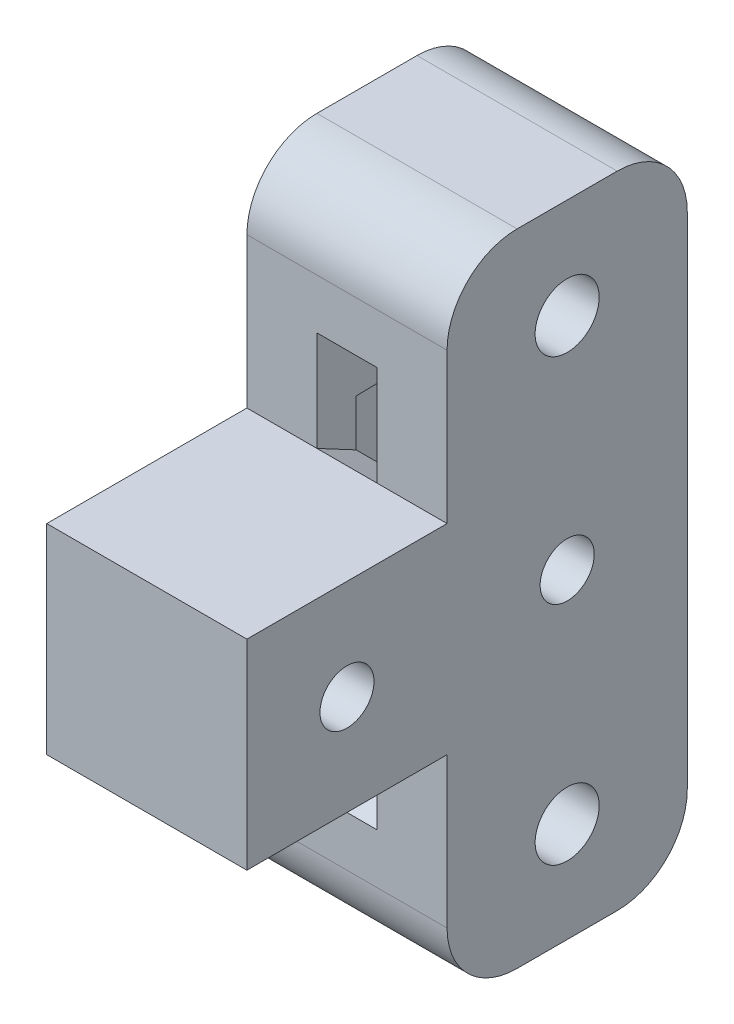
SolidWorks part; units mm, degrees
ref_plane "正面" through (0, 0, 0) normal (1, 0, 0) x (0, 1, 0)
ref_plane "平面" through (0, 0, 0) normal (0, 0, 1) x (0, 1, 0)
ref_plane "右側面" through (0, 0, 0) normal (0, 1, 0) x (-1, 0, 0)
sketch "ｽｹｯﾁ1" plane through (0, 0, 0) normal (1, 0, 0) x (0, 1, 0)
  line L0 (-24.7464, 0) -> (-24.7464, -24)
  line L1 (-24.7464, -24) -> (39.2536, -24)
  line L2 (39.2536, -24) -> (39.2536, 0)
  line L3 (39.2536, 0) -> (17.2536, 0)
  line L4 (17.2536, 0) -> (17.2536, 20)
  line L5 (17.2536, 20) -> (-2.7464, 20)
  line L6 (-2.7464, 20) -> (-2.7464, 0)
  line L7 (-2.7464, 0) -> (-24.7464, 0)
  circle A0 centre (7.2536, -12) radius 2.7
  circle A1 centre (29.2536, -12) radius 3.2
  circle A2 centre (-14.7464, -12) radius 3.2
  circle A3 centre (7.2536, 10) radius 2.7
  dimension "D7" = 5.4
  dimension "D8" = 5.4
  dimension "D9" = 6.4
  dimension "D10" = 6.4
  dimension "D1" = 64
  dimension "D2" = 22
  dimension "D3" = 22
  dimension "D4" = 24
  dimension "D5" = 24
  dimension "D6" = 44
  dimension "D11" = 10
  dimension "D12" = 32
  dimension "D13" = 54
  dimension "D14" = 32
  dimension "D15" = 12
  dimension "D16" = 12
  dimension "D17" = 12
  dimension "D18" = 34
extrude "ﾎﾞｽ - 押し出し1" add sketch "ｽｹｯﾁ1" along normal mid plane 20
sketch "ｽｹｯﾁ2" plane through (0, 0, 0) normal (0, 0, 1) x (1, 0, 0)
  line L0 (10, -2.7464) -> (-10, -2.7464) construction
  line L1 (-3, -12.7464) -> (3, -12.7464)
  line L2 (-3, -12.7464) -> (-3, -2.7464)
  line L3 (-3, -2.7464) -> (3, -2.7464)
  line L4 (3, -12.7464) -> (3, -2.7464)
  line L5 (-3, -12.7464) -> (3, -2.7464) construction
  line L6 (-3, -2.7464) -> (3, -12.7464) construction
  line L8 (10, -2.7464) -> (10, -24.7464) construction
  point P0 (0, -7.7464)
  dimension "D1" = 6
  dimension "D2" = 10
  dimension "D3" = 7
sketch "ｽｹｯﾁ3" plane through (0, 0, 0) normal (0, 0, 1) x (1, 0, 0)
  line L0 (10, 17.2536) -> (-10, 17.2536) construction
  line L1 (-3, 27.2536) -> (3, 27.2536)
  line L2 (-3, 27.2536) -> (-3, 17.2536)
  line L3 (-3, 17.2536) -> (3, 17.2536)
  line L4 (3, 27.2536) -> (3, 17.2536)
  line L5 (-3, 27.2536) -> (3, 17.2536) construction
  line L6 (-3, 17.2536) -> (3, 27.2536) construction
  line L8 (-10, 39.2536) -> (-10, 17.2536) construction
  point P0 (0, 22.2536)
  dimension "D1" = 6
  dimension "D2" = 10
  dimension "D3" = 7
sketch "ｽｹｯﾁ4" plane through (0, 0, -24) normal (0, 0, -1) x (1, 0, 0)
  line L0 (10, 24.7464) -> (-10, 24.7464) construction
  line L1 (-3.5, -4.2536) -> (3.5, -4.2536)
  line L2 (-3.5, -4.2536) -> (-3.5, -14.2536)
  line L3 (-3.5, -14.2536) -> (3.5, -14.2536)
  line L4 (3.5, -4.2536) -> (3.5, -14.2536)
  line L5 (-3.5, -4.2536) -> (3.5, -14.2536) construction
  line L6 (-3.5, -14.2536) -> (3.5, -4.2536) construction
  line L8 (10, 24.7464) -> (10, -39.2536) construction
  point P0 (0, -9.2536)
  dimension "D1" = 7
  dimension "D2" = 10
  dimension "D3" = 34
  dimension "D4" = 6.5
loft "ｶｯﾄ - ﾛﾌﾄ1" cut profiles "ｽｹｯﾁ2", "ｽｹｯﾁ4"
sketch "ｽｹｯﾁ6" plane through (0, 0, -24) normal (0, 0, -1) x (1, 0, 0)
  line L0 (-3.5, -14.2536) -> (3.5, -14.2536) construction
  line L1 (-3.5, -4.2536) -> (3.5, -4.2536)
  line L2 (-3.5, -4.2536) -> (-3.5, -14.2536)
  line L3 (-3.5, -14.2536) -> (3.5, -14.2536)
  line L4 (3.5, -4.2536) -> (3.5, -14.2536)
  line L5 (-3.5, -4.2536) -> (3.5, -14.2536) construction
  line L6 (-3.5, -14.2536) -> (3.5, -4.2536) construction
  line L7 (-10, 24.7464) -> (-10, -39.2536) construction
  point P0 (0, -9.2536)
  dimension "D1" = 10
  dimension "D2" = 7
  dimension "D3" = 6.5
loft "ｶｯﾄ - ﾛﾌﾄ2" cut profiles "ｽｹｯﾁ6", "ｽｹｯﾁ3"
sketch "ｽｹｯﾁ7" plane through (0, 0, -24) normal (0, 0, -1) x (1, 0, 0)
  line L0 (10, 24.7464) -> (-10, 24.7464) construction
  line L1 (-5, 5.2464) -> (5, 5.2464)
  line L2 (-5, 5.2464) -> (-5, -19.7536)
  line L3 (-5, -19.7536) -> (5, -19.7536)
  line L4 (5, 5.2464) -> (5, -19.7536)
  line L5 (-5, 5.2464) -> (5, -19.7536) construction
  line L6 (-5, -19.7536) -> (5, 5.2464) construction
  point P0 (0, -7.2536)
  dimension "D1" = 32
  dimension "D2" = 25
  dimension "D3" = 10
extrude "ｶｯﾄ - 押し出し3" cut sketch "ｽｹｯﾁ7" against normal blind 20
fillet "ﾌｨﾚｯﾄ3" radius 7 4 edges at (0, 39.2536, -24) (0, 39.2536, 0) (0, -24.7464, 0) (0, -24.7464, -24)
